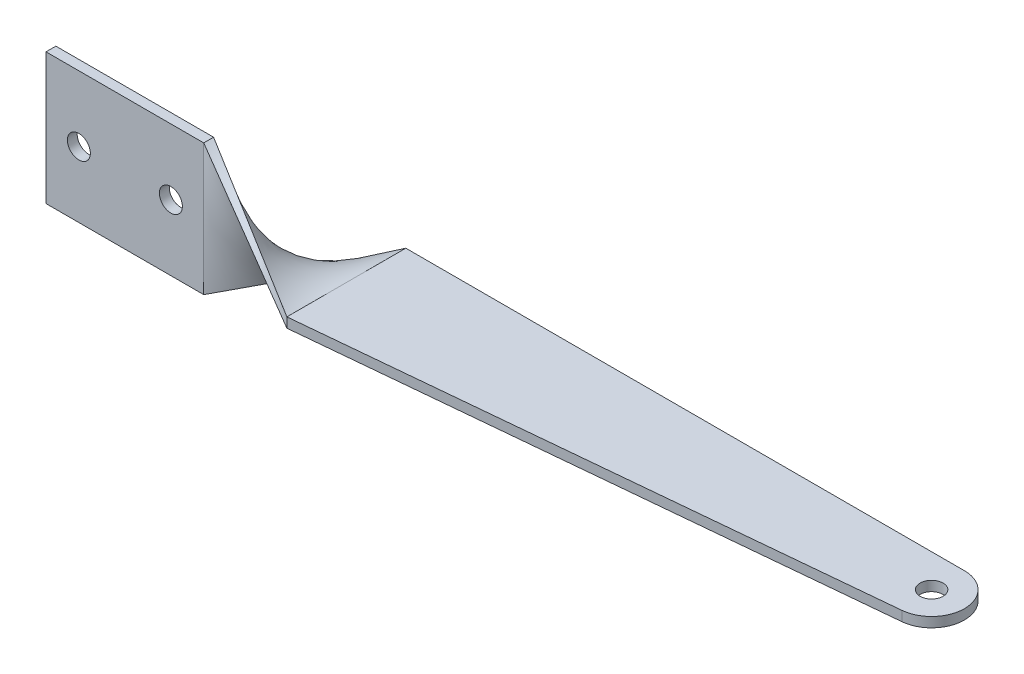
SolidWorks part; units mm, degrees
ref_plane "Front" through (0, 0, 0) normal (0, 0, 1) x (1, 0, 0)
ref_plane "Top" through (0, 0, 0) normal (0, 1, 0) x (1, 0, 0)
ref_plane "Right" through (0, 0, 0) normal (1, 0, 0) x (0, 0, -1)
sketch "Sketch1" plane through (0, 0, 0) normal (0, 0, 1) x (1, 0, 0)
  line L0 (0, 10) -> (0, -10)
  line L3 (-24, 10) -> (-24, -10)
  line L4 (0, 23.3956) -> (0, -16.6073) construction
  line L7 (0, 10) -> (-24, 10)
  line L8 (0, -10) -> (-24, -10)
  line L11 (-24, 23.3956) -> (-24, -16.6073) construction
  circle A0 centre (-5, 0) radius 1.75
  circle A1 centre (-19, 0) radius 1.75
extrude "Extrude1" add sketch "Sketch1" along normal mid plane 1.5
sketch "Sketch2" plane through (0, 0, 0) normal (0, 1, 0) x (1, 0, 0)
  line L1 (20, 9.9988) -> (20, -8.0998)
  line L4 (20, 9.9988) -> (105.0001, 9.9988)
  line L7 (20, -8.0998) -> (105.473, 0.0212)
  circle A0 centre (105.0001, 4.9988) radius 1.75
  arc A1 (105.473, 0.0212) -> (105.0001, 9.9988) centre (105.0001, 4.9988) ccw
extrude "Extrude2" add sketch "Sketch2" along normal mid plane 1.5
sketch "Sketch3" plane through (0, 0, 0) normal (1, 0, 0) x (0, 0, -1)
  line L1 (-0.75, 10) -> (0.75, 10)
  line L2 (-0.75, 10) -> (-0.75, -10)
  line L3 (-0.75, -10) -> (0.75, -10)
  line L4 (0.75, 10) -> (0.75, -10)
sketch "Sketch4" plane through (20, 0, 0) normal (-1, 0, 0) x (0, 0, 1)
  line L1 (-9.9988, 0.75) -> (8.0998, 0.75)
  line L2 (-9.9988, 0.75) -> (-9.9988, -0.75)
  line L3 (-9.9988, -0.75) -> (8.0998, -0.75)
  line L4 (8.0998, 0.75) -> (8.0998, -0.75)
loft "Loft1" add profiles "Sketch4", "Sketch3"
